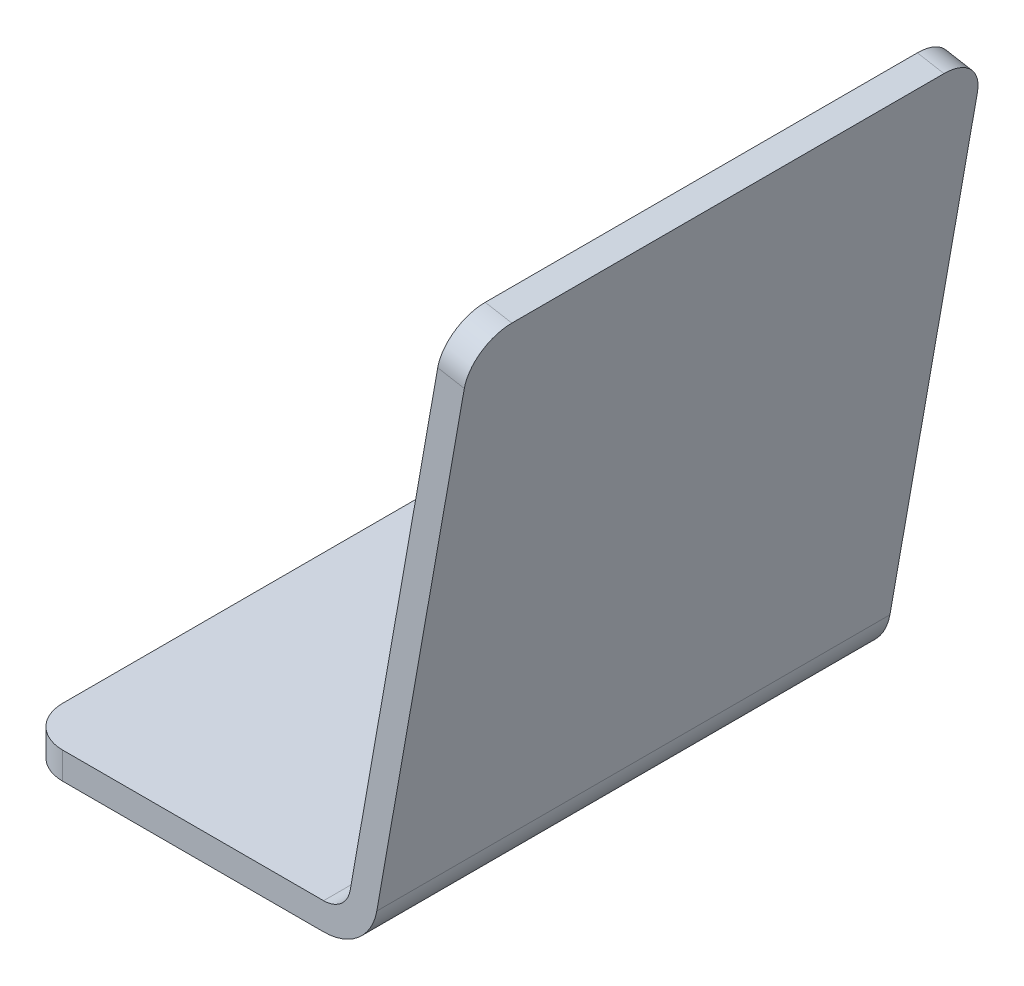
SolidWorks part; units mm, degrees
ref_plane "Plan1" through (0, 0, 0) normal (0, 0, 1) x (1, 0, 0)
ref_plane "Plan2" through (0, 0, 0) normal (0, 1, 0) x (1, 0, 0)
ref_plane "Plan3" through (0, 0, 0) normal (1, 0, 0) x (0, 0, -1)
sketch "Esquisse1" plane through (0, 0, 0) normal (0, 0, 1) x (1, 0, 0)
  line L0 (0, 0) -> (22.3218, 0)
  line L1 (24.2914, 1.6527) -> (31.2932, 41.3619)
  arc A0 (22.3218, 0) -> (24.2914, 1.6527) centre (22.3218, 2) ccw
  point P6 (24, 0)
  dimension "D4" = 2
  dimension "D1" = 100
  dimension "D2" = 42
  dimension "D3" = 24
extrude "Extru.-Mince1" add sketch "Esquisse1" along normal blind 38 thin
fillet "Congé1" radius 3 4 edges at (0, -1, 38) (0, -1, 0) (32.278, 41.1883, 38) (32.278, 41.1883, 0)
sketch "Esquisse2" plane through (0, 0, 0) normal (0, 1, 0) x (-1, 0, 0)
  line L0 (0, 35) -> (0, 3) construction
  line L1 (-3, 0) -> (-22.3218, 0) construction
  circle A0 centre (-13, 19) radius 1.6
  dimension "D1" = 3.2
  dimension "D2" = 13
  dimension "D3" = 19
extrude "Enlèv. mat.-Extru.1" cut sketch "Esquisse2" against normal through all
chamfer "Chanfrein1" distance 1 angle 30 1 edges at (11.4, 0, 19)
